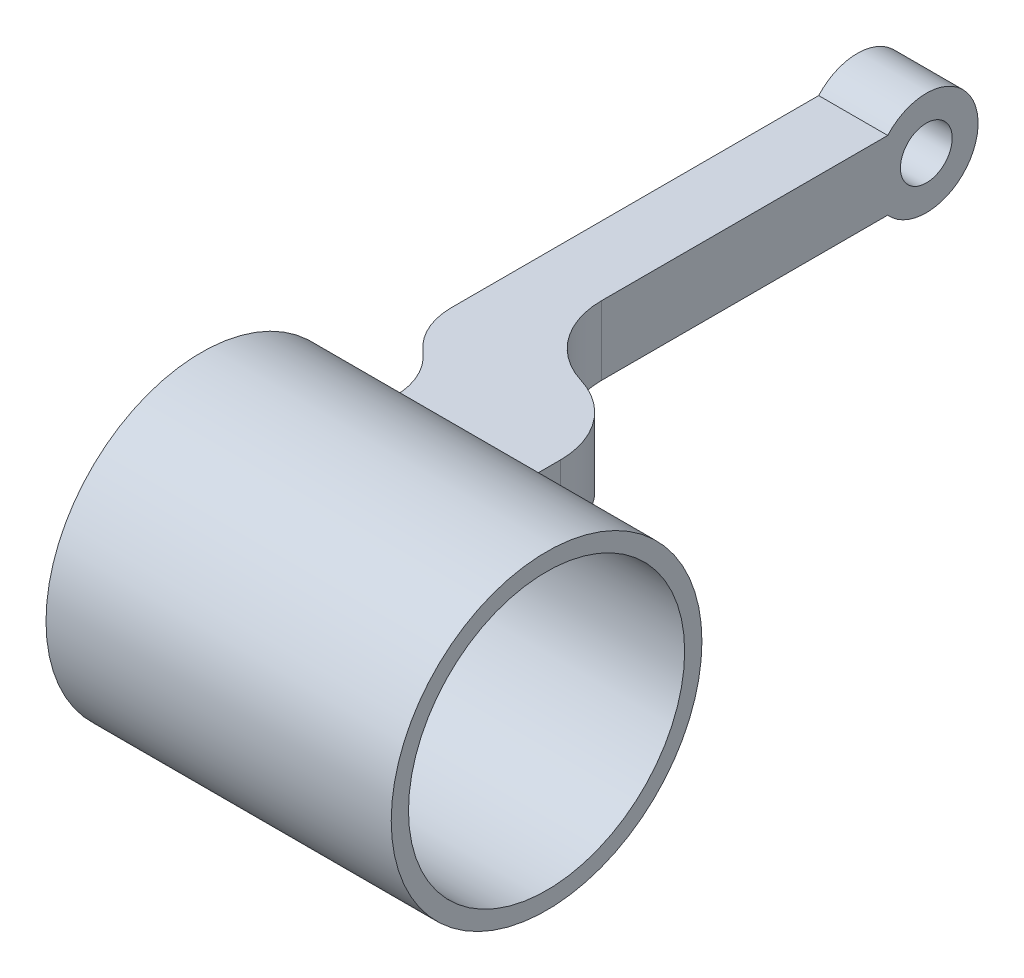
SolidWorks part; units mm, degrees
ref_plane "Front XY" through (0, 0, 0) normal (0, 0, 1) x (1, 0, 0)
ref_plane "Top XZ" through (0, 0, 0) normal (0, 1, 0) x (1, 0, 0)
ref_plane "Right YZ" through (0, 0, 0) normal (1, 0, 0) x (0, 0, -1)
sketch "Sketch1" plane through (0, 0, 0) normal (1, 0, 0) x (0, 0, -1)
  circle A0 centre (0, 0) radius 25.4
  dimension "D1" = 50.8
extrude "Extrude-Thin1" add sketch "Sketch1" along normal blind 63.5 thin
sketch "Sketch2" plane through (0, 0, 0) normal (0, 1, 0) x (1, 0, 0)
  line L0 (2.54, 25.4) -> (2.54, 33.02)
  line L1 (63.5, 25.4) -> (0, 25.4) construction
  line L2 (-6.35, 52.3223) -> (-6.35, 127)
  line L3 (27.94, 25.4) -> (27.94, 38.1)
  line L4 (6.35, 67.2547) -> (6.35, 127)
  line L5 (0, 0) -> (0, 70.5387) construction
  line L6 (-6.35, 127) -> (6.35, 127)
  line L7 (2.54, 25.4) -> (27.94, 25.4)
  arc A0 (2.54, 33.02) -> (-1.905, 42.6712) centre (-10.16, 33.02) ccw
  arc A1 (-1.905, 42.6712) -> (-6.35, 52.3223) centre (6.35, 52.3223) cw
  arc A2 (27.94, 38.1) -> (17.145, 52.6774) centre (12.7, 38.1) ccw
  arc A3 (17.145, 52.6774) -> (6.35, 67.2547) centre (21.59, 67.2547) cw
  dimension "D3" = 12.7
  dimension "D8" = 15.24
  dimension "D1" = 12.7
  dimension "D2" = 2.54
  dimension "D4" = 7.62
  dimension "D5" = 127
  dimension "D6" = 25.4
  dimension "D7" = 12.7
extrude "Extrude1" add sketch "Sketch2" along normal mid plane 12.7
sketch "Sketch3" plane through (0, 0, 0) normal (1, 0, 0) x (0, 0, -1)
  line L0 (127, 6.35) -> (127, -6.35) construction
  circle A0 centre (127, 0) radius 9.525
  dimension "D1" = 19.05
extrude "Extrude2" add sketch "Sketch3" along normal mid plane 12.7
sketch "Sketch4" plane through (0, 0, 0) normal (1, 0, 0) x (0, 0, -1)
  circle A0 centre (127, 0) radius 4.7625
  dimension "D1" = 9.525
extrude "Extrude3" cut sketch "Sketch4" against normal through all and the other way through all
